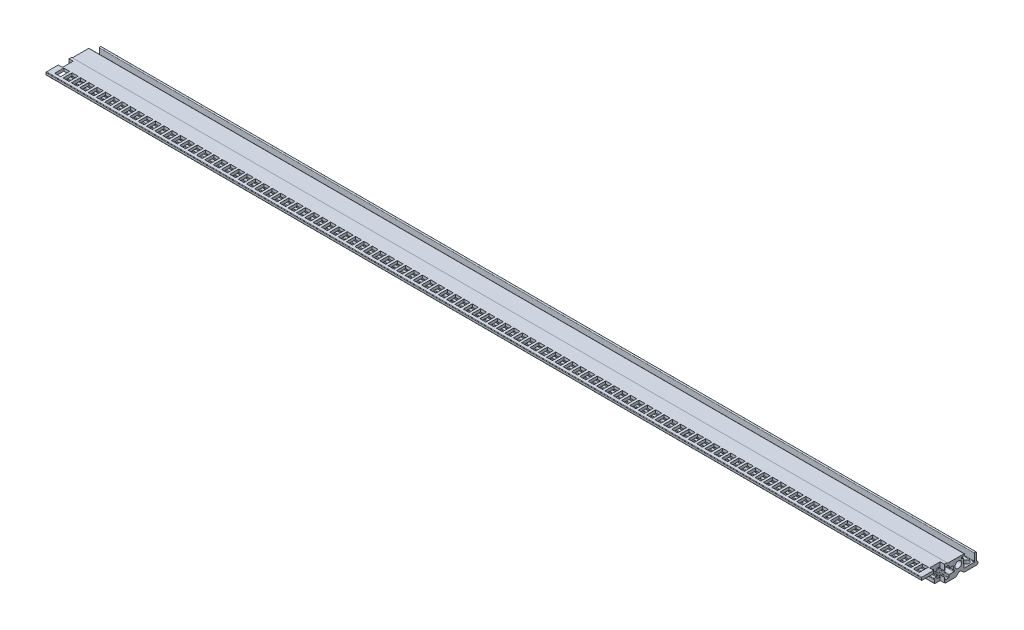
SolidWorks part; units mm, degrees
ref_plane "前视基准面" through (0, 0, 0) normal (0, 0, 1) x (1, 0, 0)
ref_plane "上视基准面" through (0, 0, 0) normal (0, 1, 0) x (1, 0, 0)
ref_plane "右视基准面" through (0, 0, 0) normal (1, 0, 0) x (0, 0, -1)
sketch "草图1" plane through (0, 0, 0) normal (1, 0, 0) x (0, 0, -1)
  line L901 (2.0061, 2.1458) -> (2.0561, 2.1458)
  line L902 (2.2561, 1.9458) -> (2.2561, -0.0542)
  line L903 (2.5561, -0.3542) -> (6.0561, -0.3542)
  line L904 (6.546, -0.7542) -> (12.6401, -0.7542)
  line L905 (12.8419, -0.6762) -> (14.6823, 0.9969)
  line L906 (15.8298, 0.9969) -> (17.6702, -0.6762)
  line L907 (17.872, -0.7542) -> (25.1561, -0.7542)
  line L908 (25.2561, 1.6874) -> (25.2561, 6.0458)
  line L909 (24.2561, 6.0458) -> (24.2561, 1.7458)
  line L910 (23.9561, 1.4458) -> (18.0561, 1.4458)
  line L911 (17.7561, 1.7458) -> (17.7561, 3.0993)
  line L912 (17.5561, 3.4458) -> (17.5561, 6.7458)
  line L913 (17.2561, 7.0458) -> (16.3561, 7.0458)
  line L914 (16.0561, 7.3458) -> (16.0561, 7.7458)
  line L915 (16.3561, 8.0458) -> (17.7561, 8.0458)
  line L916 (18.0561, 8.3458) -> (18.0561, 8.7458)
  line L917 (17.7561, 9.0458) -> (-7.9439, 9.0458)
  line L918 (-8.2439, 8.7458) -> (-8.2439, 8.1458)
  line L919 (-7.9439, 7.8458) -> (1.4561, 7.8458)
  line L920 (1.7561, 7.5458) -> (1.7561, 6.3458)
  line L921 (2.0561, 6.0458) -> (3.4561, 6.0458)
  line L922 (3.7561, 6.3458) -> (3.7561, 6.7458)
  line L923 (4.0561, 7.0458) -> (5.1561, 7.0458)
  line L924 (5.4561, 6.7458) -> (5.4561, 6.3458)
  line L925 (6.0561, 6.3458) -> (6.0561, 7.4058)
  line L926 (6.3561, 7.7058) -> (8.1561, 7.7058)
  line L927 (8.4561, 7.4058) -> (8.4561, 6.3458)
  line L928 (8.7561, 6.0458) -> (10.98, 6.0458)
  line L929 (11.646, 2.6458) -> (8.7561, 2.6458)
  line L930 (8.4561, 2.3458) -> (8.4561, 1.2858)
  line L931 (8.1561, 0.9858) -> (6.3561, 0.9858)
  line L932 (6.0561, 1.2858) -> (6.0561, 2.3458)
  line L933 (5.4561, 2.3458) -> (5.4561, 1.9458)
  line L934 (5.1561, 1.6458) -> (4.0561, 1.6458)
  line L935 (3.7561, 1.9458) -> (3.7561, 2.3458)
  line L936 (3.4561, 2.6458) -> (2.0061, 2.6458)
  circle A0 centre (14.2561, 5.0458) radius 2
  arc A133 (2.0061, 2.6458) -> (2.0061, 2.1458) centre (2.0061, 2.3958) ccw
  arc A134 (2.2561, 1.9458) -> (2.0561, 2.1458) centre (2.0561, 1.9458) ccw
  arc A135 (2.2561, -0.0542) -> (2.5561, -0.3542) centre (2.5561, -0.0542) ccw
  arc A136 (6.35, -0.5942) -> (6.0561, -0.3542) centre (6.0561, -0.6542) ccw
  arc A137 (6.35, -0.5942) -> (6.546, -0.7542) centre (6.546, -0.5542) ccw
  arc A138 (12.6401, -0.7542) -> (12.8419, -0.6762) centre (12.6401, -0.4542) ccw
  arc A139 (15.0701, 1.0103) -> (14.6823, 0.9969) centre (14.8841, 0.7749) ccw
  arc A140 (15.0701, 1.0103) -> (15.442, 1.0103) centre (15.2561, 1.2458) ccw
  arc A141 (15.8298, 0.9969) -> (15.442, 1.0103) centre (15.628, 0.7749) ccw
  arc A142 (17.6702, -0.6762) -> (17.872, -0.7542) centre (17.872, -0.4542) ccw
  arc A143 (25.1561, -0.7542) -> (25.4703, 1.3999) centre (25.1561, 0.3458) ccw
  arc A144 (25.2561, 1.6874) -> (25.4703, 1.3999) centre (25.5561, 1.6874) ccw
  arc A145 (25.2561, 6.0458) -> (24.2561, 6.0458) centre (24.7561, 6.0458) ccw
  arc A146 (23.9561, 1.4458) -> (24.2561, 1.7458) centre (23.9561, 1.7458) ccw
  arc A147 (17.7561, 1.7458) -> (18.0561, 1.4458) centre (18.0561, 1.7458) ccw
  arc A148 (17.7561, 3.0993) -> (17.6561, 3.2726) centre (17.5561, 3.0993) ccw
  arc A149 (17.5561, 3.4458) -> (17.6561, 3.2726) centre (17.7561, 3.4458) ccw
  arc A150 (17.5561, 6.7458) -> (17.2561, 7.0458) centre (17.2561, 6.7458) ccw
  arc A151 (16.0561, 7.3458) -> (16.3561, 7.0458) centre (16.3561, 7.3458) ccw
  arc A152 (16.3561, 8.0458) -> (16.0561, 7.7458) centre (16.3561, 7.7458) ccw
  arc A153 (17.7561, 8.0458) -> (18.0561, 8.3458) centre (17.7561, 8.3458) ccw
  arc A154 (18.0561, 8.7458) -> (17.7561, 9.0458) centre (17.7561, 8.7458) ccw
  arc A155 (-7.9439, 9.0458) -> (-8.2439, 8.7458) centre (-7.9439, 8.7458) ccw
  arc A156 (-8.2439, 8.1458) -> (-7.9439, 7.8458) centre (-7.9439, 8.1458) ccw
  arc A157 (1.7561, 7.5458) -> (1.4561, 7.8458) centre (1.4561, 7.5458) ccw
  arc A158 (1.7561, 6.3458) -> (2.0561, 6.0458) centre (2.0561, 6.3458) ccw
  arc A159 (3.4561, 6.0458) -> (3.7561, 6.3458) centre (3.4561, 6.3458) ccw
  arc A160 (4.0561, 7.0458) -> (3.7561, 6.7458) centre (4.0561, 6.7458) ccw
  arc A161 (5.4561, 6.7458) -> (5.1561, 7.0458) centre (5.1561, 6.7458) ccw
  arc A162 (5.4561, 6.3458) -> (6.0561, 6.3458) centre (5.7561, 6.3458) ccw
  arc A163 (6.3561, 7.7058) -> (6.0561, 7.4058) centre (6.3561, 7.4058) ccw
  arc A164 (8.4561, 7.4058) -> (8.1561, 7.7058) centre (8.1561, 7.4058) ccw
  arc A165 (8.4561, 6.3458) -> (8.7561, 6.0458) centre (8.7561, 6.3458) ccw
  arc A166 (11.2734, 5.6831) -> (10.98, 6.0458) centre (10.98, 5.7458) ccw
  arc A167 (11.2734, 5.6831) -> (11.8797, 3.1338) centre (14.2561, 5.0458) ccw
  arc A168 (11.646, 2.6458) -> (11.8797, 3.1338) centre (11.646, 2.9458) ccw
  arc A169 (8.7561, 2.6458) -> (8.4561, 2.3458) centre (8.7561, 2.3458) ccw
  arc A170 (8.1561, 0.9858) -> (8.4561, 1.2858) centre (8.1561, 1.2858) ccw
  arc A171 (6.0561, 1.2858) -> (6.3561, 0.9858) centre (6.3561, 1.2858) ccw
  arc A172 (6.0561, 2.3458) -> (5.4561, 2.3458) centre (5.7561, 2.3458) ccw
  arc A173 (5.1561, 1.6458) -> (5.4561, 1.9458) centre (5.1561, 1.9458) ccw
  arc A174 (3.7561, 1.9458) -> (4.0561, 1.6458) centre (4.0561, 1.9458) ccw
  arc A175 (3.7561, 2.3458) -> (3.4561, 2.6458) centre (3.4561, 2.3458) ccw
  dimension "D2" = 0.3
  dimension "D3" = 0.3
  dimension "D6" = 4
  dimension "D1" = 0.6
  dimension "D4" = 25.7
  dimension "D5" = 9.4
extrude "凸台-拉伸1" add sketch "草图1" along normal mid plane 533.4
sketch "草图7" plane through (266.7, 0, 0) normal (1, 0, 0) x (0, 0, -1)
  line L0 (-7.9439, 9.0458) -> (-8.2439, 9.0458)
  line L1 (-8.2439, 9.0458) -> (-8.2439, 8.7458)
  arc A0 (-7.9439, 9.0458) -> (-8.2439, 8.7458) centre (-7.9439, 8.7458) ccw construction
  arc A1 (-7.9439, 9.0458) -> (-8.2439, 8.7458) centre (-7.9439, 8.7458) ccw
extrude "凸台-拉伸4" add sketch "草图7" against normal through all
sketch "草图6" plane through (-266.7, 0, 0) normal (-1, 0, 0) x (0, 0, 1)
  line L0 (-7.8061, 9.0458) -> (8.2439, 9.0458)
  line L1 (-17.7561, 9.0458) -> (8.2439, 9.0458) construction
  line L4 (8.2439, 9.0458) -> (8.2439, 9.5458)
  line L5 (8.2439, 9.5458) -> (-7.3061, 9.5458)
  line L6 (-7.3061, 9.5458) -> (-7.8061, 9.0458)
extrude "凸台-拉伸3" add sketch "草图6" against normal through all
sketch "草图3" plane through (0, 9.5458, 0) normal (0, 1, 0) x (1, 0, 0)
  line L0 (266.7, 17.7561) -> (266.7, 7.8061) construction
  line L1 (266.7, 5.7561) -> (264.16, 5.7561)
  line L2 (266.7, 5.7561) -> (266.7, -0.7439)
  line L3 (266.7, -0.7439) -> (264.16, -0.7439)
  line L4 (264.16, 5.7561) -> (264.16, -0.7439)
  line L5 (266.7, -8.2439) -> (-266.7, -8.2439) construction
  line L7 (0, -8.2439) -> (0, 17.7561) construction
  line L9 (266.7, 17.7561) -> (-266.7, 17.7561) construction
  line L10 (-264.16, 5.7561) -> (-264.16, -0.7439)
  line L11 (-266.7, -0.7439) -> (-264.16, -0.7439)
  line L12 (-266.7, 5.7561) -> (-266.7, -0.7439)
  line L13 (-266.7, 5.7561) -> (-264.16, 5.7561)
  dimension "D1" = 2.54
  dimension "D2" = 7.5
  dimension "D3" = 6.5
extrude "切除-拉伸1" cut sketch "草图3" against normal up to surface (10.3 mm away)
sketch "草图4" plane through (0, -0.7542, 0) normal (0, -1, 0) x (-1, 0, 0)
  line L0 (-264.16, 1.7561) -> (264.16, 1.7561) construction
  line L1 (-266.7, 17.872) -> (-266.7, 25.1561) construction
  circle A0 centre (-264.16, 21.7061) radius 1.65
  circle A1 centre (-259.08, 21.7061) radius 1.65
  circle A2 centre (-254, 21.7061) radius 1.65
  circle A3 centre (-248.92, 21.7061) radius 1.65
  circle A4 centre (-243.84, 21.7061) radius 1.65
  circle A5 centre (-238.76, 21.7061) radius 1.65
  circle A6 centre (-233.68, 21.7061) radius 1.65
  circle A7 centre (-228.6, 21.7061) radius 1.65
  circle A8 centre (-223.52, 21.7061) radius 1.65
  circle A9 centre (-218.44, 21.7061) radius 1.65
  circle A10 centre (-213.36, 21.7061) radius 1.65
  circle A11 centre (-208.28, 21.7061) radius 1.65
  circle A12 centre (-203.2, 21.7061) radius 1.65
  circle A13 centre (-198.12, 21.7061) radius 1.65
  circle A14 centre (-193.04, 21.7061) radius 1.65
  circle A15 centre (-187.96, 21.7061) radius 1.65
  circle A16 centre (-182.88, 21.7061) radius 1.65
  circle A17 centre (-177.8, 21.7061) radius 1.65
  circle A18 centre (-172.72, 21.7061) radius 1.65
  circle A19 centre (-167.64, 21.7061) radius 1.65
  circle A20 centre (-162.56, 21.7061) radius 1.65
  circle A21 centre (-157.48, 21.7061) radius 1.65
  circle A22 centre (-152.4, 21.7061) radius 1.65
  circle A23 centre (-147.32, 21.7061) radius 1.65
  circle A24 centre (-142.24, 21.7061) radius 1.65
  circle A25 centre (-137.16, 21.7061) radius 1.65
  circle A26 centre (-132.08, 21.7061) radius 1.65
  circle A27 centre (-127, 21.7061) radius 1.65
  circle A28 centre (-121.92, 21.7061) radius 1.65
  circle A29 centre (-116.84, 21.7061) radius 1.65
  circle A30 centre (-111.76, 21.7061) radius 1.65
  circle A31 centre (-106.68, 21.7061) radius 1.65
  circle A32 centre (-101.6, 21.7061) radius 1.65
  circle A33 centre (-96.52, 21.7061) radius 1.65
  circle A34 centre (-91.44, 21.7061) radius 1.65
  circle A35 centre (-86.36, 21.7061) radius 1.65
  circle A36 centre (-81.28, 21.7061) radius 1.65
  circle A37 centre (-76.2, 21.7061) radius 1.65
  circle A38 centre (-71.12, 21.7061) radius 1.65
  circle A39 centre (-66.04, 21.7061) radius 1.65
  circle A40 centre (-60.96, 21.7061) radius 1.65
  circle A41 centre (-55.88, 21.7061) radius 1.65
  circle A42 centre (-50.8, 21.7061) radius 1.65
  circle A43 centre (-45.72, 21.7061) radius 1.65
  circle A44 centre (-40.64, 21.7061) radius 1.65
  circle A45 centre (-35.56, 21.7061) radius 1.65
  circle A46 centre (-30.48, 21.7061) radius 1.65
  circle A47 centre (-25.4, 21.7061) radius 1.65
  circle A48 centre (-20.32, 21.7061) radius 1.65
  circle A49 centre (-15.24, 21.7061) radius 1.65
  circle A50 centre (-10.16, 21.7061) radius 1.65
  circle A51 centre (-5.08, 21.7061) radius 1.65
  circle A52 centre (0, 21.7061) radius 1.65
  circle A53 centre (5.08, 21.7061) radius 1.65
  circle A54 centre (10.16, 21.7061) radius 1.65
  circle A55 centre (15.24, 21.7061) radius 1.65
  circle A56 centre (20.32, 21.7061) radius 1.65
  circle A57 centre (25.4, 21.7061) radius 1.65
  circle A58 centre (30.48, 21.7061) radius 1.65
  circle A59 centre (35.56, 21.7061) radius 1.65
  circle A60 centre (40.64, 21.7061) radius 1.65
  circle A61 centre (45.72, 21.7061) radius 1.65
  circle A62 centre (50.8, 21.7061) radius 1.65
  circle A63 centre (55.88, 21.7061) radius 1.65
  circle A64 centre (60.96, 21.7061) radius 1.65
  circle A65 centre (66.04, 21.7061) radius 1.65
  circle A66 centre (71.12, 21.7061) radius 1.65
  circle A67 centre (76.2, 21.7061) radius 1.65
  circle A68 centre (81.28, 21.7061) radius 1.65
  circle A69 centre (86.36, 21.7061) radius 1.65
  circle A70 centre (91.44, 21.7061) radius 1.65
  circle A71 centre (96.52, 21.7061) radius 1.65
  circle A72 centre (101.6, 21.7061) radius 1.65
  circle A73 centre (106.68, 21.7061) radius 1.65
  circle A74 centre (111.76, 21.7061) radius 1.65
  circle A75 centre (116.84, 21.7061) radius 1.65
  circle A76 centre (121.92, 21.7061) radius 1.65
  circle A77 centre (127, 21.7061) radius 1.65
  circle A78 centre (132.08, 21.7061) radius 1.65
  circle A79 centre (137.16, 21.7061) radius 1.65
  circle A80 centre (142.24, 21.7061) radius 1.65
  circle A81 centre (147.32, 21.7061) radius 1.65
  circle A82 centre (152.4, 21.7061) radius 1.65
  circle A83 centre (157.48, 21.7061) radius 1.65
  circle A84 centre (162.56, 21.7061) radius 1.65
  circle A85 centre (167.64, 21.7061) radius 1.65
  circle A86 centre (172.72, 21.7061) radius 1.65
  circle A87 centre (177.8, 21.7061) radius 1.65
  circle A88 centre (182.88, 21.7061) radius 1.65
  circle A89 centre (187.96, 21.7061) radius 1.65
  circle A90 centre (193.04, 21.7061) radius 1.65
  circle A91 centre (198.12, 21.7061) radius 1.65
  circle A92 centre (203.2, 21.7061) radius 1.65
  circle A93 centre (208.28, 21.7061) radius 1.65
  circle A94 centre (213.36, 21.7061) radius 1.65
  circle A95 centre (218.44, 21.7061) radius 1.65
  circle A96 centre (223.52, 21.7061) radius 1.65
  circle A97 centre (228.6, 21.7061) radius 1.65
  circle A98 centre (233.68, 21.7061) radius 1.65
  circle A99 centre (238.76, 21.7061) radius 1.65
  circle A100 centre (243.84, 21.7061) radius 1.65
  circle A101 centre (248.92, 21.7061) radius 1.65
  circle A102 centre (254, 21.7061) radius 1.65
  circle A103 centre (259.08, 21.7061) radius 1.65
  circle A104 centre (264.16, 21.7061) radius 1.65
extrude "切除-拉伸2" cut sketch "草图4" against normal up to surface (9.8 mm away)
sketch "草图5" plane through (0, 9.5458, 0) normal (0, 1, 0) x (1, 0, 0)
  line L0 (-266.7, 17.7561) -> (-266.7, 7.8061) construction
  line L1 (-259.82, -6.1939) -> (-263.42, -6.1939)
  line L2 (-259.82, -6.1939) -> (-259.82, -0.6939)
  line L3 (-259.82, -0.6939) -> (-263.42, -0.6939)
  line L4 (-263.42, -6.1939) -> (-263.42, -0.6939)
  line L5 (-259.82, -6.1939) -> (-263.42, -0.6939) construction
  line L6 (-259.82, -0.6939) -> (-263.42, -6.1939) construction
  line L7 (166.9, -6.1939) -> (163.3, -6.1939)
  line L8 (-254.74, -6.1939) -> (-258.34, -6.1939)
  line L9 (-254.74, -6.1939) -> (-254.74, -0.6939)
  line L10 (-254.74, -0.6939) -> (-258.34, -0.6939)
  line L11 (-258.34, -6.1939) -> (-258.34, -0.6939)
  line L12 (-254.74, -6.1939) -> (-258.34, -0.6939) construction
  line L13 (-254.74, -0.6939) -> (-258.34, -6.1939) construction
  line L14 (-249.66, -6.1939) -> (-253.26, -6.1939)
  line L15 (-249.66, -6.1939) -> (-249.66, -0.6939)
  line L16 (-249.66, -0.6939) -> (-253.26, -0.6939)
  line L17 (-253.26, -6.1939) -> (-253.26, -0.6939)
  line L18 (-249.66, -6.1939) -> (-253.26, -0.6939) construction
  line L19 (-249.66, -0.6939) -> (-253.26, -6.1939) construction
  line L20 (-244.58, -6.1939) -> (-248.18, -6.1939)
  line L21 (-244.58, -6.1939) -> (-244.58, -0.6939)
  line L22 (-244.58, -0.6939) -> (-248.18, -0.6939)
  line L23 (-248.18, -6.1939) -> (-248.18, -0.6939)
  line L24 (-244.58, -6.1939) -> (-248.18, -0.6939) construction
  line L25 (-244.58, -0.6939) -> (-248.18, -6.1939) construction
  line L26 (-239.5, -6.1939) -> (-243.1, -6.1939)
  line L27 (-239.5, -6.1939) -> (-239.5, -0.6939)
  line L28 (-239.5, -0.6939) -> (-243.1, -0.6939)
  line L29 (-243.1, -6.1939) -> (-243.1, -0.6939)
  line L30 (-239.5, -6.1939) -> (-243.1, -0.6939) construction
  line L31 (-239.5, -0.6939) -> (-243.1, -6.1939) construction
  line L32 (-234.42, -6.1939) -> (-238.02, -6.1939)
  line L33 (-234.42, -6.1939) -> (-234.42, -0.6939)
  line L34 (-234.42, -0.6939) -> (-238.02, -0.6939)
  line L35 (-238.02, -6.1939) -> (-238.02, -0.6939)
  line L36 (-234.42, -6.1939) -> (-238.02, -0.6939) construction
  line L37 (-234.42, -0.6939) -> (-238.02, -6.1939) construction
  line L38 (-229.34, -6.1939) -> (-232.94, -6.1939)
  line L39 (-229.34, -6.1939) -> (-229.34, -0.6939)
  line L40 (-229.34, -0.6939) -> (-232.94, -0.6939)
  line L41 (-232.94, -6.1939) -> (-232.94, -0.6939)
  line L42 (-229.34, -6.1939) -> (-232.94, -0.6939) construction
  line L43 (-229.34, -0.6939) -> (-232.94, -6.1939) construction
  line L44 (-224.26, -6.1939) -> (-227.86, -6.1939)
  line L45 (-224.26, -6.1939) -> (-224.26, -0.6939)
  line L46 (-224.26, -0.6939) -> (-227.86, -0.6939)
  line L47 (-227.86, -6.1939) -> (-227.86, -0.6939)
  line L48 (-224.26, -6.1939) -> (-227.86, -0.6939) construction
  line L49 (-224.26, -0.6939) -> (-227.86, -6.1939) construction
  line L50 (-219.18, -6.1939) -> (-222.78, -6.1939)
  line L51 (-219.18, -6.1939) -> (-219.18, -0.6939)
  line L52 (-219.18, -0.6939) -> (-222.78, -0.6939)
  line L53 (-222.78, -6.1939) -> (-222.78, -0.6939)
  line L54 (-219.18, -6.1939) -> (-222.78, -0.6939) construction
  line L55 (-219.18, -0.6939) -> (-222.78, -6.1939) construction
  line L56 (-214.1, -6.1939) -> (-217.7, -6.1939)
  line L57 (-214.1, -6.1939) -> (-214.1, -0.6939)
  line L58 (-214.1, -0.6939) -> (-217.7, -0.6939)
  line L59 (-217.7, -6.1939) -> (-217.7, -0.6939)
  line L60 (-214.1, -6.1939) -> (-217.7, -0.6939) construction
  line L61 (-214.1, -0.6939) -> (-217.7, -6.1939) construction
  line L62 (-209.02, -6.1939) -> (-212.62, -6.1939)
  line L63 (-209.02, -6.1939) -> (-209.02, -0.6939)
  line L64 (-209.02, -0.6939) -> (-212.62, -0.6939)
  line L65 (-212.62, -6.1939) -> (-212.62, -0.6939)
  line L66 (-209.02, -6.1939) -> (-212.62, -0.6939) construction
  line L67 (-209.02, -0.6939) -> (-212.62, -6.1939) construction
  line L68 (-203.94, -6.1939) -> (-207.54, -6.1939)
  line L69 (-203.94, -6.1939) -> (-203.94, -0.6939)
  line L70 (-203.94, -0.6939) -> (-207.54, -0.6939)
  line L71 (-207.54, -6.1939) -> (-207.54, -0.6939)
  line L72 (-203.94, -6.1939) -> (-207.54, -0.6939) construction
  line L73 (-203.94, -0.6939) -> (-207.54, -6.1939) construction
  line L74 (-198.86, -6.1939) -> (-202.46, -6.1939)
  line L75 (-198.86, -6.1939) -> (-198.86, -0.6939)
  line L76 (-198.86, -0.6939) -> (-202.46, -0.6939)
  line L77 (-202.46, -6.1939) -> (-202.46, -0.6939)
  line L78 (-198.86, -6.1939) -> (-202.46, -0.6939) construction
  line L79 (-198.86, -0.6939) -> (-202.46, -6.1939) construction
  line L80 (-193.78, -6.1939) -> (-197.38, -6.1939)
  line L81 (-193.78, -6.1939) -> (-193.78, -0.6939)
  line L82 (-193.78, -0.6939) -> (-197.38, -0.6939)
  line L83 (-197.38, -6.1939) -> (-197.38, -0.6939)
  line L84 (-193.78, -6.1939) -> (-197.38, -0.6939) construction
  line L85 (-193.78, -0.6939) -> (-197.38, -6.1939) construction
  line L86 (-188.7, -6.1939) -> (-192.3, -6.1939)
  line L87 (-188.7, -6.1939) -> (-188.7, -0.6939)
  line L88 (-188.7, -0.6939) -> (-192.3, -0.6939)
  line L89 (-192.3, -6.1939) -> (-192.3, -0.6939)
  line L90 (-188.7, -6.1939) -> (-192.3, -0.6939) construction
  line L91 (-188.7, -0.6939) -> (-192.3, -6.1939) construction
  line L92 (-183.62, -6.1939) -> (-187.22, -6.1939)
  line L93 (-183.62, -6.1939) -> (-183.62, -0.6939)
  line L94 (-183.62, -0.6939) -> (-187.22, -0.6939)
  line L95 (-187.22, -6.1939) -> (-187.22, -0.6939)
  line L96 (-183.62, -6.1939) -> (-187.22, -0.6939) construction
  line L97 (-183.62, -0.6939) -> (-187.22, -6.1939) construction
  line L98 (-178.54, -6.1939) -> (-182.14, -6.1939)
  line L99 (-178.54, -6.1939) -> (-178.54, -0.6939)
  line L100 (-178.54, -0.6939) -> (-182.14, -0.6939)
  line L101 (-182.14, -6.1939) -> (-182.14, -0.6939)
  line L102 (-178.54, -6.1939) -> (-182.14, -0.6939) construction
  line L103 (-178.54, -0.6939) -> (-182.14, -6.1939) construction
  line L104 (-173.46, -6.1939) -> (-177.06, -6.1939)
  line L105 (-173.46, -6.1939) -> (-173.46, -0.6939)
  line L106 (-173.46, -0.6939) -> (-177.06, -0.6939)
  line L107 (-177.06, -6.1939) -> (-177.06, -0.6939)
  line L108 (-173.46, -6.1939) -> (-177.06, -0.6939) construction
  line L109 (-173.46, -0.6939) -> (-177.06, -6.1939) construction
  line L110 (-168.38, -6.1939) -> (-171.98, -6.1939)
  line L111 (-168.38, -6.1939) -> (-168.38, -0.6939)
  line L112 (-168.38, -0.6939) -> (-171.98, -0.6939)
  line L113 (-171.98, -6.1939) -> (-171.98, -0.6939)
  line L114 (-168.38, -6.1939) -> (-171.98, -0.6939) construction
  line L115 (-168.38, -0.6939) -> (-171.98, -6.1939) construction
  line L116 (-163.3, -6.1939) -> (-166.9, -6.1939)
  line L117 (-163.3, -6.1939) -> (-163.3, -0.6939)
  line L118 (-163.3, -0.6939) -> (-166.9, -0.6939)
  line L119 (-166.9, -6.1939) -> (-166.9, -0.6939)
  line L120 (-163.3, -6.1939) -> (-166.9, -0.6939) construction
  line L121 (-163.3, -0.6939) -> (-166.9, -6.1939) construction
  line L122 (-158.22, -6.1939) -> (-161.82, -6.1939)
  line L123 (-158.22, -6.1939) -> (-158.22, -0.6939)
  line L124 (-158.22, -0.6939) -> (-161.82, -0.6939)
  line L125 (-161.82, -6.1939) -> (-161.82, -0.6939)
  line L126 (-158.22, -6.1939) -> (-161.82, -0.6939) construction
  line L127 (-158.22, -0.6939) -> (-161.82, -6.1939) construction
  line L128 (-153.14, -6.1939) -> (-156.74, -6.1939)
  line L129 (-153.14, -6.1939) -> (-153.14, -0.6939)
  line L130 (-153.14, -0.6939) -> (-156.74, -0.6939)
  line L131 (-156.74, -6.1939) -> (-156.74, -0.6939)
  line L132 (-153.14, -6.1939) -> (-156.74, -0.6939) construction
  line L133 (-153.14, -0.6939) -> (-156.74, -6.1939) construction
  line L134 (-148.06, -6.1939) -> (-151.66, -6.1939)
  line L135 (-148.06, -6.1939) -> (-148.06, -0.6939)
  line L136 (-148.06, -0.6939) -> (-151.66, -0.6939)
  line L137 (-151.66, -6.1939) -> (-151.66, -0.6939)
  line L138 (-148.06, -6.1939) -> (-151.66, -0.6939) construction
  line L139 (-148.06, -0.6939) -> (-151.66, -6.1939) construction
  line L140 (-142.98, -6.1939) -> (-146.58, -6.1939)
  line L141 (-142.98, -6.1939) -> (-142.98, -0.6939)
  line L142 (-142.98, -0.6939) -> (-146.58, -0.6939)
  line L143 (-146.58, -6.1939) -> (-146.58, -0.6939)
  line L144 (-142.98, -6.1939) -> (-146.58, -0.6939) construction
  line L145 (-142.98, -0.6939) -> (-146.58, -6.1939) construction
  line L146 (-137.9, -6.1939) -> (-141.5, -6.1939)
  line L147 (-137.9, -6.1939) -> (-137.9, -0.6939)
  line L148 (-137.9, -0.6939) -> (-141.5, -0.6939)
  line L149 (-141.5, -6.1939) -> (-141.5, -0.6939)
  line L150 (-137.9, -6.1939) -> (-141.5, -0.6939) construction
  line L151 (-137.9, -0.6939) -> (-141.5, -6.1939) construction
  line L152 (-132.82, -6.1939) -> (-136.42, -6.1939)
  line L153 (-132.82, -6.1939) -> (-132.82, -0.6939)
  line L154 (-132.82, -0.6939) -> (-136.42, -0.6939)
  line L155 (-136.42, -6.1939) -> (-136.42, -0.6939)
  line L156 (-132.82, -6.1939) -> (-136.42, -0.6939) construction
  line L157 (-132.82, -0.6939) -> (-136.42, -6.1939) construction
  line L158 (-127.74, -6.1939) -> (-131.34, -6.1939)
  line L159 (-127.74, -6.1939) -> (-127.74, -0.6939)
  line L160 (-127.74, -0.6939) -> (-131.34, -0.6939)
  line L161 (-131.34, -6.1939) -> (-131.34, -0.6939)
  line L162 (-127.74, -6.1939) -> (-131.34, -0.6939) construction
  line L163 (-127.74, -0.6939) -> (-131.34, -6.1939) construction
  line L164 (-122.66, -6.1939) -> (-126.26, -6.1939)
  line L165 (-122.66, -6.1939) -> (-122.66, -0.6939)
  line L166 (-122.66, -0.6939) -> (-126.26, -0.6939)
  line L167 (-126.26, -6.1939) -> (-126.26, -0.6939)
  line L168 (-122.66, -6.1939) -> (-126.26, -0.6939) construction
  line L169 (-122.66, -0.6939) -> (-126.26, -6.1939) construction
  line L170 (-117.58, -6.1939) -> (-121.18, -6.1939)
  line L171 (-117.58, -6.1939) -> (-117.58, -0.6939)
  line L172 (-117.58, -0.6939) -> (-121.18, -0.6939)
  line L173 (-121.18, -6.1939) -> (-121.18, -0.6939)
  line L174 (-117.58, -6.1939) -> (-121.18, -0.6939) construction
  line L175 (-117.58, -0.6939) -> (-121.18, -6.1939) construction
  line L176 (-112.5, -6.1939) -> (-116.1, -6.1939)
  line L177 (-112.5, -6.1939) -> (-112.5, -0.6939)
  line L178 (-112.5, -0.6939) -> (-116.1, -0.6939)
  line L179 (-116.1, -6.1939) -> (-116.1, -0.6939)
  line L180 (-112.5, -6.1939) -> (-116.1, -0.6939) construction
  line L181 (-112.5, -0.6939) -> (-116.1, -6.1939) construction
  line L182 (-107.42, -6.1939) -> (-111.02, -6.1939)
  line L183 (-107.42, -6.1939) -> (-107.42, -0.6939)
  line L184 (-107.42, -0.6939) -> (-111.02, -0.6939)
  line L185 (-111.02, -6.1939) -> (-111.02, -0.6939)
  line L186 (-107.42, -6.1939) -> (-111.02, -0.6939) construction
  line L187 (-107.42, -0.6939) -> (-111.02, -6.1939) construction
  line L188 (-102.34, -6.1939) -> (-105.94, -6.1939)
  line L189 (-102.34, -6.1939) -> (-102.34, -0.6939)
  line L190 (-102.34, -0.6939) -> (-105.94, -0.6939)
  line L191 (-105.94, -6.1939) -> (-105.94, -0.6939)
  line L192 (-102.34, -6.1939) -> (-105.94, -0.6939) construction
  line L193 (-102.34, -0.6939) -> (-105.94, -6.1939) construction
  line L194 (-97.26, -6.1939) -> (-100.86, -6.1939)
  line L195 (-97.26, -6.1939) -> (-97.26, -0.6939)
  line L196 (-97.26, -0.6939) -> (-100.86, -0.6939)
  line L197 (-100.86, -6.1939) -> (-100.86, -0.6939)
  line L198 (-97.26, -6.1939) -> (-100.86, -0.6939) construction
  line L199 (-97.26, -0.6939) -> (-100.86, -6.1939) construction
  line L200 (-92.18, -6.1939) -> (-95.78, -6.1939)
  line L201 (-92.18, -6.1939) -> (-92.18, -0.6939)
  line L202 (-92.18, -0.6939) -> (-95.78, -0.6939)
  line L203 (-95.78, -6.1939) -> (-95.78, -0.6939)
  line L204 (-92.18, -6.1939) -> (-95.78, -0.6939) construction
  line L205 (-92.18, -0.6939) -> (-95.78, -6.1939) construction
  line L206 (-87.1, -6.1939) -> (-90.7, -6.1939)
  line L207 (-87.1, -6.1939) -> (-87.1, -0.6939)
  line L208 (-87.1, -0.6939) -> (-90.7, -0.6939)
  line L209 (-90.7, -6.1939) -> (-90.7, -0.6939)
  line L210 (-87.1, -6.1939) -> (-90.7, -0.6939) construction
  line L211 (-87.1, -0.6939) -> (-90.7, -6.1939) construction
  line L212 (-82.02, -6.1939) -> (-85.62, -6.1939)
  line L213 (-82.02, -6.1939) -> (-82.02, -0.6939)
  line L214 (-82.02, -0.6939) -> (-85.62, -0.6939)
  line L215 (-85.62, -6.1939) -> (-85.62, -0.6939)
  line L216 (-82.02, -6.1939) -> (-85.62, -0.6939) construction
  line L217 (-82.02, -0.6939) -> (-85.62, -6.1939) construction
  line L218 (-76.94, -6.1939) -> (-80.54, -6.1939)
  line L219 (-76.94, -6.1939) -> (-76.94, -0.6939)
  line L220 (-76.94, -0.6939) -> (-80.54, -0.6939)
  line L221 (-80.54, -6.1939) -> (-80.54, -0.6939)
  line L222 (-76.94, -6.1939) -> (-80.54, -0.6939) construction
  line L223 (-76.94, -0.6939) -> (-80.54, -6.1939) construction
  line L224 (-71.86, -6.1939) -> (-75.46, -6.1939)
  line L225 (-71.86, -6.1939) -> (-71.86, -0.6939)
  line L226 (-71.86, -0.6939) -> (-75.46, -0.6939)
  line L227 (-75.46, -6.1939) -> (-75.46, -0.6939)
  line L228 (-71.86, -6.1939) -> (-75.46, -0.6939) construction
  line L229 (-71.86, -0.6939) -> (-75.46, -6.1939) construction
  line L230 (-66.78, -6.1939) -> (-70.38, -6.1939)
  line L231 (-66.78, -6.1939) -> (-66.78, -0.6939)
  line L232 (-66.78, -0.6939) -> (-70.38, -0.6939)
  line L233 (-70.38, -6.1939) -> (-70.38, -0.6939)
  line L234 (-66.78, -6.1939) -> (-70.38, -0.6939) construction
  line L235 (-66.78, -0.6939) -> (-70.38, -6.1939) construction
  line L236 (-61.7, -6.1939) -> (-65.3, -6.1939)
  line L237 (-61.7, -6.1939) -> (-61.7, -0.6939)
  line L238 (-61.7, -0.6939) -> (-65.3, -0.6939)
  line L239 (-65.3, -6.1939) -> (-65.3, -0.6939)
  line L240 (-61.7, -6.1939) -> (-65.3, -0.6939) construction
  line L241 (-61.7, -0.6939) -> (-65.3, -6.1939) construction
  line L242 (-56.62, -6.1939) -> (-60.22, -6.1939)
  line L243 (-56.62, -6.1939) -> (-56.62, -0.6939)
  line L244 (-56.62, -0.6939) -> (-60.22, -0.6939)
  line L245 (-60.22, -6.1939) -> (-60.22, -0.6939)
  line L246 (-56.62, -6.1939) -> (-60.22, -0.6939) construction
  line L247 (-56.62, -0.6939) -> (-60.22, -6.1939) construction
  line L248 (-51.54, -6.1939) -> (-55.14, -6.1939)
  line L249 (-51.54, -6.1939) -> (-51.54, -0.6939)
  line L250 (-51.54, -0.6939) -> (-55.14, -0.6939)
  line L251 (-55.14, -6.1939) -> (-55.14, -0.6939)
  line L252 (-51.54, -6.1939) -> (-55.14, -0.6939) construction
  line L253 (-51.54, -0.6939) -> (-55.14, -6.1939) construction
  line L254 (-46.46, -6.1939) -> (-50.06, -6.1939)
  line L255 (-46.46, -6.1939) -> (-46.46, -0.6939)
  line L256 (-46.46, -0.6939) -> (-50.06, -0.6939)
  line L257 (-50.06, -6.1939) -> (-50.06, -0.6939)
  line L258 (-46.46, -6.1939) -> (-50.06, -0.6939) construction
  line L259 (-46.46, -0.6939) -> (-50.06, -6.1939) construction
  line L260 (-41.38, -6.1939) -> (-44.98, -6.1939)
  line L261 (-41.38, -6.1939) -> (-41.38, -0.6939)
  line L262 (-41.38, -0.6939) -> (-44.98, -0.6939)
  line L263 (-44.98, -6.1939) -> (-44.98, -0.6939)
  line L264 (-41.38, -6.1939) -> (-44.98, -0.6939) construction
  line L265 (-41.38, -0.6939) -> (-44.98, -6.1939) construction
  line L266 (-36.3, -6.1939) -> (-39.9, -6.1939)
  line L267 (-36.3, -6.1939) -> (-36.3, -0.6939)
  line L268 (-36.3, -0.6939) -> (-39.9, -0.6939)
  line L269 (-39.9, -6.1939) -> (-39.9, -0.6939)
  line L270 (-36.3, -6.1939) -> (-39.9, -0.6939) construction
  line L271 (-36.3, -0.6939) -> (-39.9, -6.1939) construction
  line L272 (-31.22, -6.1939) -> (-34.82, -6.1939)
  line L273 (-31.22, -6.1939) -> (-31.22, -0.6939)
  line L274 (-31.22, -0.6939) -> (-34.82, -0.6939)
  line L275 (-34.82, -6.1939) -> (-34.82, -0.6939)
  line L276 (-31.22, -6.1939) -> (-34.82, -0.6939) construction
  line L277 (-31.22, -0.6939) -> (-34.82, -6.1939) construction
  line L278 (-26.14, -6.1939) -> (-29.74, -6.1939)
  line L279 (-26.14, -6.1939) -> (-26.14, -0.6939)
  line L280 (-26.14, -0.6939) -> (-29.74, -0.6939)
  line L281 (-29.74, -6.1939) -> (-29.74, -0.6939)
  line L282 (-26.14, -6.1939) -> (-29.74, -0.6939) construction
  line L283 (-26.14, -0.6939) -> (-29.74, -6.1939) construction
  line L284 (-21.06, -6.1939) -> (-24.66, -6.1939)
  line L285 (-21.06, -6.1939) -> (-21.06, -0.6939)
  line L286 (-21.06, -0.6939) -> (-24.66, -0.6939)
  line L287 (-24.66, -6.1939) -> (-24.66, -0.6939)
  line L288 (-21.06, -6.1939) -> (-24.66, -0.6939) construction
  line L289 (-21.06, -0.6939) -> (-24.66, -6.1939) construction
  line L290 (-15.98, -6.1939) -> (-19.58, -6.1939)
  line L291 (-15.98, -6.1939) -> (-15.98, -0.6939)
  line L292 (-15.98, -0.6939) -> (-19.58, -0.6939)
  line L293 (-19.58, -6.1939) -> (-19.58, -0.6939)
  line L294 (-15.98, -6.1939) -> (-19.58, -0.6939) construction
  line L295 (-15.98, -0.6939) -> (-19.58, -6.1939) construction
  line L296 (-10.9, -6.1939) -> (-14.5, -6.1939)
  line L297 (-10.9, -6.1939) -> (-10.9, -0.6939)
  line L298 (-10.9, -0.6939) -> (-14.5, -0.6939)
  line L299 (-14.5, -6.1939) -> (-14.5, -0.6939)
  line L300 (-10.9, -6.1939) -> (-14.5, -0.6939) construction
  line L301 (-10.9, -0.6939) -> (-14.5, -6.1939) construction
  line L302 (-5.82, -6.1939) -> (-9.42, -6.1939)
  line L303 (-5.82, -6.1939) -> (-5.82, -0.6939)
  line L304 (-5.82, -0.6939) -> (-9.42, -0.6939)
  line L305 (-9.42, -6.1939) -> (-9.42, -0.6939)
  line L306 (-5.82, -6.1939) -> (-9.42, -0.6939) construction
  line L307 (-5.82, -0.6939) -> (-9.42, -6.1939) construction
  line L308 (-0.74, -6.1939) -> (-4.34, -6.1939)
  line L309 (-0.74, -6.1939) -> (-0.74, -0.6939)
  line L310 (-0.74, -0.6939) -> (-4.34, -0.6939)
  line L311 (-4.34, -6.1939) -> (-4.34, -0.6939)
  line L312 (-0.74, -6.1939) -> (-4.34, -0.6939) construction
  line L313 (-0.74, -0.6939) -> (-4.34, -6.1939) construction
  line L314 (4.34, -6.1939) -> (0.74, -6.1939)
  line L315 (4.34, -6.1939) -> (4.34, -0.6939)
  line L316 (4.34, -0.6939) -> (0.74, -0.6939)
  line L317 (0.74, -6.1939) -> (0.74, -0.6939)
  line L318 (4.34, -6.1939) -> (0.74, -0.6939) construction
  line L319 (4.34, -0.6939) -> (0.74, -6.1939) construction
  line L320 (9.42, -6.1939) -> (5.82, -6.1939)
  line L321 (9.42, -6.1939) -> (9.42, -0.6939)
  line L322 (9.42, -0.6939) -> (5.82, -0.6939)
  line L323 (5.82, -6.1939) -> (5.82, -0.6939)
  line L324 (9.42, -6.1939) -> (5.82, -0.6939) construction
  line L325 (9.42, -0.6939) -> (5.82, -6.1939) construction
  line L326 (14.5, -6.1939) -> (10.9, -6.1939)
  line L327 (14.5, -6.1939) -> (14.5, -0.6939)
  line L328 (14.5, -0.6939) -> (10.9, -0.6939)
  line L329 (10.9, -6.1939) -> (10.9, -0.6939)
  line L330 (14.5, -6.1939) -> (10.9, -0.6939) construction
  line L331 (14.5, -0.6939) -> (10.9, -6.1939) construction
  line L332 (19.58, -6.1939) -> (15.98, -6.1939)
  line L333 (19.58, -6.1939) -> (19.58, -0.6939)
  line L334 (19.58, -0.6939) -> (15.98, -0.6939)
  line L335 (15.98, -6.1939) -> (15.98, -0.6939)
  line L336 (19.58, -6.1939) -> (15.98, -0.6939) construction
  line L337 (19.58, -0.6939) -> (15.98, -6.1939) construction
  line L338 (24.66, -6.1939) -> (21.06, -6.1939)
  line L339 (24.66, -6.1939) -> (24.66, -0.6939)
  line L340 (24.66, -0.6939) -> (21.06, -0.6939)
  line L341 (21.06, -6.1939) -> (21.06, -0.6939)
  line L342 (24.66, -6.1939) -> (21.06, -0.6939) construction
  line L343 (24.66, -0.6939) -> (21.06, -6.1939) construction
  line L344 (29.74, -6.1939) -> (26.14, -6.1939)
  line L345 (29.74, -6.1939) -> (29.74, -0.6939)
  line L346 (29.74, -0.6939) -> (26.14, -0.6939)
  line L347 (26.14, -6.1939) -> (26.14, -0.6939)
  line L348 (29.74, -6.1939) -> (26.14, -0.6939) construction
  line L349 (29.74, -0.6939) -> (26.14, -6.1939) construction
  line L350 (34.82, -6.1939) -> (31.22, -6.1939)
  line L351 (34.82, -6.1939) -> (34.82, -0.6939)
  line L352 (34.82, -0.6939) -> (31.22, -0.6939)
  line L353 (31.22, -6.1939) -> (31.22, -0.6939)
  line L354 (34.82, -6.1939) -> (31.22, -0.6939) construction
  line L355 (34.82, -0.6939) -> (31.22, -6.1939) construction
  line L356 (39.9, -6.1939) -> (36.3, -6.1939)
  line L357 (39.9, -6.1939) -> (39.9, -0.6939)
  line L358 (39.9, -0.6939) -> (36.3, -0.6939)
  line L359 (36.3, -6.1939) -> (36.3, -0.6939)
  line L360 (39.9, -6.1939) -> (36.3, -0.6939) construction
  line L361 (39.9, -0.6939) -> (36.3, -6.1939) construction
  line L362 (44.98, -6.1939) -> (41.38, -6.1939)
  line L363 (44.98, -6.1939) -> (44.98, -0.6939)
  line L364 (44.98, -0.6939) -> (41.38, -0.6939)
  line L365 (41.38, -6.1939) -> (41.38, -0.6939)
  line L366 (44.98, -6.1939) -> (41.38, -0.6939) construction
  line L367 (44.98, -0.6939) -> (41.38, -6.1939) construction
  line L368 (50.06, -6.1939) -> (46.46, -6.1939)
  line L369 (50.06, -6.1939) -> (50.06, -0.6939)
  line L370 (50.06, -0.6939) -> (46.46, -0.6939)
  line L371 (46.46, -6.1939) -> (46.46, -0.6939)
  line L372 (50.06, -6.1939) -> (46.46, -0.6939) construction
  line L373 (50.06, -0.6939) -> (46.46, -6.1939) construction
  line L374 (55.14, -6.1939) -> (51.54, -6.1939)
  line L375 (55.14, -6.1939) -> (55.14, -0.6939)
  line L376 (55.14, -0.6939) -> (51.54, -0.6939)
  line L377 (51.54, -6.1939) -> (51.54, -0.6939)
  line L378 (55.14, -6.1939) -> (51.54, -0.6939) construction
  line L379 (55.14, -0.6939) -> (51.54, -6.1939) construction
  line L380 (60.22, -6.1939) -> (56.62, -6.1939)
  line L381 (60.22, -6.1939) -> (60.22, -0.6939)
  line L382 (60.22, -0.6939) -> (56.62, -0.6939)
  line L383 (56.62, -6.1939) -> (56.62, -0.6939)
  line L384 (60.22, -6.1939) -> (56.62, -0.6939) construction
  line L385 (60.22, -0.6939) -> (56.62, -6.1939) construction
  line L386 (65.3, -6.1939) -> (61.7, -6.1939)
  line L387 (65.3, -6.1939) -> (65.3, -0.6939)
  line L388 (65.3, -0.6939) -> (61.7, -0.6939)
  line L389 (61.7, -6.1939) -> (61.7, -0.6939)
  line L390 (65.3, -6.1939) -> (61.7, -0.6939) construction
  line L391 (65.3, -0.6939) -> (61.7, -6.1939) construction
  line L392 (70.38, -6.1939) -> (66.78, -6.1939)
  line L393 (70.38, -6.1939) -> (70.38, -0.6939)
  line L394 (70.38, -0.6939) -> (66.78, -0.6939)
  line L395 (66.78, -6.1939) -> (66.78, -0.6939)
  line L396 (70.38, -6.1939) -> (66.78, -0.6939) construction
  line L397 (70.38, -0.6939) -> (66.78, -6.1939) construction
  line L398 (75.46, -6.1939) -> (71.86, -6.1939)
  line L399 (75.46, -6.1939) -> (75.46, -0.6939)
  line L400 (75.46, -0.6939) -> (71.86, -0.6939)
  line L401 (71.86, -6.1939) -> (71.86, -0.6939)
  line L402 (75.46, -6.1939) -> (71.86, -0.6939) construction
  line L403 (75.46, -0.6939) -> (71.86, -6.1939) construction
  line L404 (80.54, -6.1939) -> (76.94, -6.1939)
  line L405 (80.54, -6.1939) -> (80.54, -0.6939)
  line L406 (80.54, -0.6939) -> (76.94, -0.6939)
  line L407 (76.94, -6.1939) -> (76.94, -0.6939)
  line L408 (80.54, -6.1939) -> (76.94, -0.6939) construction
  line L409 (80.54, -0.6939) -> (76.94, -6.1939) construction
  line L410 (85.62, -6.1939) -> (82.02, -6.1939)
  line L411 (85.62, -6.1939) -> (85.62, -0.6939)
  line L412 (85.62, -0.6939) -> (82.02, -0.6939)
  line L413 (82.02, -6.1939) -> (82.02, -0.6939)
  line L414 (85.62, -6.1939) -> (82.02, -0.6939) construction
  line L415 (85.62, -0.6939) -> (82.02, -6.1939) construction
  line L416 (90.7, -6.1939) -> (87.1, -6.1939)
  line L417 (90.7, -6.1939) -> (90.7, -0.6939)
  line L418 (90.7, -0.6939) -> (87.1, -0.6939)
  line L419 (87.1, -6.1939) -> (87.1, -0.6939)
  line L420 (90.7, -6.1939) -> (87.1, -0.6939) construction
  line L421 (90.7, -0.6939) -> (87.1, -6.1939) construction
  line L422 (95.78, -6.1939) -> (92.18, -6.1939)
  line L423 (95.78, -6.1939) -> (95.78, -0.6939)
  line L424 (95.78, -0.6939) -> (92.18, -0.6939)
  line L425 (92.18, -6.1939) -> (92.18, -0.6939)
  line L426 (95.78, -6.1939) -> (92.18, -0.6939) construction
  line L427 (95.78, -0.6939) -> (92.18, -6.1939) construction
  line L428 (100.86, -6.1939) -> (97.26, -6.1939)
  line L429 (100.86, -6.1939) -> (100.86, -0.6939)
  line L430 (100.86, -0.6939) -> (97.26, -0.6939)
  line L431 (97.26, -6.1939) -> (97.26, -0.6939)
  line L432 (100.86, -6.1939) -> (97.26, -0.6939) construction
  line L433 (100.86, -0.6939) -> (97.26, -6.1939) construction
  line L434 (105.94, -6.1939) -> (102.34, -6.1939)
  line L435 (105.94, -6.1939) -> (105.94, -0.6939)
  line L436 (105.94, -0.6939) -> (102.34, -0.6939)
  line L437 (102.34, -6.1939) -> (102.34, -0.6939)
  line L438 (105.94, -6.1939) -> (102.34, -0.6939) construction
  line L439 (105.94, -0.6939) -> (102.34, -6.1939) construction
  line L440 (111.02, -6.1939) -> (107.42, -6.1939)
  line L441 (111.02, -6.1939) -> (111.02, -0.6939)
  line L442 (111.02, -0.6939) -> (107.42, -0.6939)
  line L443 (107.42, -6.1939) -> (107.42, -0.6939)
  line L444 (111.02, -6.1939) -> (107.42, -0.6939) construction
  line L445 (111.02, -0.6939) -> (107.42, -6.1939) construction
  line L446 (116.1, -6.1939) -> (112.5, -6.1939)
  line L447 (116.1, -6.1939) -> (116.1, -0.6939)
  line L448 (116.1, -0.6939) -> (112.5, -0.6939)
  line L449 (112.5, -6.1939) -> (112.5, -0.6939)
  line L450 (116.1, -6.1939) -> (112.5, -0.6939) construction
  line L451 (116.1, -0.6939) -> (112.5, -6.1939) construction
  line L452 (121.18, -6.1939) -> (117.58, -6.1939)
  line L453 (121.18, -6.1939) -> (121.18, -0.6939)
  line L454 (121.18, -0.6939) -> (117.58, -0.6939)
  line L455 (117.58, -6.1939) -> (117.58, -0.6939)
  line L456 (121.18, -6.1939) -> (117.58, -0.6939) construction
  line L457 (121.18, -0.6939) -> (117.58, -6.1939) construction
  line L458 (126.26, -6.1939) -> (122.66, -6.1939)
  line L459 (126.26, -6.1939) -> (126.26, -0.6939)
  line L460 (126.26, -0.6939) -> (122.66, -0.6939)
  line L461 (122.66, -6.1939) -> (122.66, -0.6939)
  line L462 (126.26, -6.1939) -> (122.66, -0.6939) construction
  line L463 (126.26, -0.6939) -> (122.66, -6.1939) construction
  line L464 (131.34, -6.1939) -> (127.74, -6.1939)
  line L465 (131.34, -6.1939) -> (131.34, -0.6939)
  line L466 (131.34, -0.6939) -> (127.74, -0.6939)
  line L467 (127.74, -6.1939) -> (127.74, -0.6939)
  line L468 (131.34, -6.1939) -> (127.74, -0.6939) construction
  line L469 (131.34, -0.6939) -> (127.74, -6.1939) construction
  line L470 (136.42, -6.1939) -> (132.82, -6.1939)
  line L471 (136.42, -6.1939) -> (136.42, -0.6939)
  line L472 (136.42, -0.6939) -> (132.82, -0.6939)
  line L473 (132.82, -6.1939) -> (132.82, -0.6939)
  line L474 (136.42, -6.1939) -> (132.82, -0.6939) construction
  line L475 (136.42, -0.6939) -> (132.82, -6.1939) construction
  line L476 (141.5, -6.1939) -> (137.9, -6.1939)
  line L477 (141.5, -6.1939) -> (141.5, -0.6939)
  line L478 (141.5, -0.6939) -> (137.9, -0.6939)
  line L479 (137.9, -6.1939) -> (137.9, -0.6939)
  line L480 (141.5, -6.1939) -> (137.9, -0.6939) construction
  line L481 (141.5, -0.6939) -> (137.9, -6.1939) construction
  line L482 (146.58, -6.1939) -> (142.98, -6.1939)
  line L483 (146.58, -6.1939) -> (146.58, -0.6939)
  line L484 (146.58, -0.6939) -> (142.98, -0.6939)
  line L485 (142.98, -6.1939) -> (142.98, -0.6939)
  line L486 (146.58, -6.1939) -> (142.98, -0.6939) construction
  line L487 (146.58, -0.6939) -> (142.98, -6.1939) construction
  line L488 (151.66, -6.1939) -> (148.06, -6.1939)
  line L489 (151.66, -6.1939) -> (151.66, -0.6939)
  line L490 (151.66, -0.6939) -> (148.06, -0.6939)
  line L491 (148.06, -6.1939) -> (148.06, -0.6939)
  line L492 (151.66, -6.1939) -> (148.06, -0.6939) construction
  line L493 (151.66, -0.6939) -> (148.06, -6.1939) construction
  line L494 (156.74, -6.1939) -> (153.14, -6.1939)
  line L495 (156.74, -6.1939) -> (156.74, -0.6939)
  line L496 (156.74, -0.6939) -> (153.14, -0.6939)
  line L497 (153.14, -6.1939) -> (153.14, -0.6939)
  line L498 (156.74, -6.1939) -> (153.14, -0.6939) construction
  line L499 (156.74, -0.6939) -> (153.14, -6.1939) construction
  line L500 (161.82, -6.1939) -> (158.22, -6.1939)
  line L501 (161.82, -6.1939) -> (161.82, -0.6939)
  line L502 (161.82, -0.6939) -> (158.22, -0.6939)
  line L503 (158.22, -6.1939) -> (158.22, -0.6939)
  line L504 (161.82, -6.1939) -> (158.22, -0.6939) construction
  line L505 (161.82, -0.6939) -> (158.22, -6.1939) construction
  line L506 (266.7, -8.2439) -> (-266.7, -8.2439) construction
  line L507 (166.9, -6.1939) -> (166.9, -0.6939)
  line L508 (166.9, -0.6939) -> (163.3, -0.6939)
  line L509 (163.3, -6.1939) -> (163.3, -0.6939)
  line L510 (166.9, -6.1939) -> (163.3, -0.6939) construction
  line L511 (166.9, -0.6939) -> (163.3, -6.1939) construction
  line L512 (171.98, -6.1939) -> (168.38, -6.1939)
  line L513 (171.98, -6.1939) -> (171.98, -0.6939)
  line L514 (171.98, -0.6939) -> (168.38, -0.6939)
  line L515 (168.38, -6.1939) -> (168.38, -0.6939)
  line L516 (171.98, -6.1939) -> (168.38, -0.6939) construction
  line L517 (171.98, -0.6939) -> (168.38, -6.1939) construction
  line L518 (177.06, -6.1939) -> (173.46, -6.1939)
  line L519 (177.06, -6.1939) -> (177.06, -0.6939)
  line L520 (177.06, -0.6939) -> (173.46, -0.6939)
  line L521 (173.46, -6.1939) -> (173.46, -0.6939)
  line L522 (177.06, -6.1939) -> (173.46, -0.6939) construction
  line L523 (177.06, -0.6939) -> (173.46, -6.1939) construction
  line L524 (182.14, -6.1939) -> (178.54, -6.1939)
  line L525 (182.14, -6.1939) -> (182.14, -0.6939)
  line L526 (182.14, -0.6939) -> (178.54, -0.6939)
  line L527 (178.54, -6.1939) -> (178.54, -0.6939)
  line L528 (182.14, -6.1939) -> (178.54, -0.6939) construction
  line L529 (182.14, -0.6939) -> (178.54, -6.1939) construction
  line L530 (187.22, -6.1939) -> (183.62, -6.1939)
  line L531 (187.22, -6.1939) -> (187.22, -0.6939)
  line L532 (187.22, -0.6939) -> (183.62, -0.6939)
  line L533 (183.62, -6.1939) -> (183.62, -0.6939)
  line L534 (187.22, -6.1939) -> (183.62, -0.6939) construction
  line L535 (187.22, -0.6939) -> (183.62, -6.1939) construction
  line L536 (192.3, -6.1939) -> (188.7, -6.1939)
  line L537 (192.3, -6.1939) -> (192.3, -0.6939)
  line L538 (192.3, -0.6939) -> (188.7, -0.6939)
  line L539 (188.7, -6.1939) -> (188.7, -0.6939)
  line L540 (192.3, -6.1939) -> (188.7, -0.6939) construction
  line L541 (192.3, -0.6939) -> (188.7, -6.1939) construction
  line L542 (197.38, -6.1939) -> (193.78, -6.1939)
  line L543 (197.38, -6.1939) -> (197.38, -0.6939)
  line L544 (197.38, -0.6939) -> (193.78, -0.6939)
  line L545 (193.78, -6.1939) -> (193.78, -0.6939)
  line L546 (197.38, -6.1939) -> (193.78, -0.6939) construction
  line L547 (197.38, -0.6939) -> (193.78, -6.1939) construction
  line L548 (202.46, -6.1939) -> (198.86, -6.1939)
  line L549 (202.46, -6.1939) -> (202.46, -0.6939)
  line L550 (202.46, -0.6939) -> (198.86, -0.6939)
  line L551 (198.86, -6.1939) -> (198.86, -0.6939)
  line L552 (202.46, -6.1939) -> (198.86, -0.6939) construction
  line L553 (202.46, -0.6939) -> (198.86, -6.1939) construction
  line L554 (207.54, -6.1939) -> (203.94, -6.1939)
  line L555 (207.54, -6.1939) -> (207.54, -0.6939)
  line L556 (207.54, -0.6939) -> (203.94, -0.6939)
  line L557 (203.94, -6.1939) -> (203.94, -0.6939)
  line L558 (207.54, -6.1939) -> (203.94, -0.6939) construction
  line L559 (207.54, -0.6939) -> (203.94, -6.1939) construction
  line L560 (212.62, -6.1939) -> (209.02, -6.1939)
  line L561 (212.62, -6.1939) -> (212.62, -0.6939)
  line L562 (212.62, -0.6939) -> (209.02, -0.6939)
  line L563 (209.02, -6.1939) -> (209.02, -0.6939)
  line L564 (212.62, -6.1939) -> (209.02, -0.6939) construction
  line L565 (212.62, -0.6939) -> (209.02, -6.1939) construction
  line L566 (217.7, -6.1939) -> (214.1, -6.1939)
  line L567 (217.7, -6.1939) -> (217.7, -0.6939)
  line L568 (217.7, -0.6939) -> (214.1, -0.6939)
  line L569 (214.1, -6.1939) -> (214.1, -0.6939)
  line L570 (217.7, -6.1939) -> (214.1, -0.6939) construction
  line L571 (217.7, -0.6939) -> (214.1, -6.1939) construction
  line L572 (222.78, -6.1939) -> (219.18, -6.1939)
  line L573 (222.78, -6.1939) -> (222.78, -0.6939)
  line L574 (222.78, -0.6939) -> (219.18, -0.6939)
  line L575 (219.18, -6.1939) -> (219.18, -0.6939)
  line L576 (222.78, -6.1939) -> (219.18, -0.6939) construction
  line L577 (222.78, -0.6939) -> (219.18, -6.1939) construction
  line L578 (227.86, -6.1939) -> (224.26, -6.1939)
  line L579 (227.86, -6.1939) -> (227.86, -0.6939)
  line L580 (227.86, -0.6939) -> (224.26, -0.6939)
  line L581 (224.26, -6.1939) -> (224.26, -0.6939)
  line L582 (227.86, -6.1939) -> (224.26, -0.6939) construction
  line L583 (227.86, -0.6939) -> (224.26, -6.1939) construction
  line L584 (232.94, -6.1939) -> (229.34, -6.1939)
  line L585 (232.94, -6.1939) -> (232.94, -0.6939)
  line L586 (232.94, -0.6939) -> (229.34, -0.6939)
  line L587 (229.34, -6.1939) -> (229.34, -0.6939)
  line L588 (232.94, -6.1939) -> (229.34, -0.6939) construction
  line L589 (232.94, -0.6939) -> (229.34, -6.1939) construction
  line L590 (238.02, -6.1939) -> (234.42, -6.1939)
  line L591 (238.02, -6.1939) -> (238.02, -0.6939)
  line L592 (238.02, -0.6939) -> (234.42, -0.6939)
  line L593 (234.42, -6.1939) -> (234.42, -0.6939)
  line L594 (238.02, -6.1939) -> (234.42, -0.6939) construction
  line L595 (238.02, -0.6939) -> (234.42, -6.1939) construction
  line L596 (243.1, -6.1939) -> (239.5, -6.1939)
  line L597 (243.1, -6.1939) -> (243.1, -0.6939)
  line L598 (243.1, -0.6939) -> (239.5, -0.6939)
  line L599 (239.5, -6.1939) -> (239.5, -0.6939)
  line L600 (243.1, -6.1939) -> (239.5, -0.6939) construction
  line L601 (243.1, -0.6939) -> (239.5, -6.1939) construction
  line L602 (248.18, -6.1939) -> (244.58, -6.1939)
  line L603 (248.18, -6.1939) -> (248.18, -0.6939)
  line L604 (248.18, -0.6939) -> (244.58, -0.6939)
  line L605 (244.58, -6.1939) -> (244.58, -0.6939)
  line L606 (248.18, -6.1939) -> (244.58, -0.6939) construction
  line L607 (248.18, -0.6939) -> (244.58, -6.1939) construction
  line L608 (253.26, -6.1939) -> (249.66, -6.1939)
  line L609 (253.26, -6.1939) -> (253.26, -0.6939)
  line L610 (253.26, -0.6939) -> (249.66, -0.6939)
  line L611 (249.66, -6.1939) -> (249.66, -0.6939)
  line L612 (253.26, -6.1939) -> (249.66, -0.6939) construction
  line L613 (253.26, -0.6939) -> (249.66, -6.1939) construction
  line L614 (258.34, -6.1939) -> (254.74, -6.1939)
  line L615 (258.34, -6.1939) -> (258.34, -0.6939)
  line L616 (258.34, -0.6939) -> (254.74, -0.6939)
  line L617 (254.74, -6.1939) -> (254.74, -0.6939)
  line L618 (258.34, -6.1939) -> (254.74, -0.6939) construction
  line L619 (258.34, -0.6939) -> (254.74, -6.1939) construction
  line L620 (263.42, -6.1939) -> (259.82, -6.1939)
  line L621 (263.42, -6.1939) -> (263.42, -0.6939)
  line L622 (263.42, -0.6939) -> (259.82, -0.6939)
  line L623 (259.82, -6.1939) -> (259.82, -0.6939)
  line L624 (263.42, -6.1939) -> (259.82, -0.6939) construction
  line L625 (263.42, -0.6939) -> (259.82, -6.1939) construction
  point P0 (-261.62, -3.4439)
  point P9 (165.1, -3.4439)
  point P10 (-256.54, -3.4439)
  point P15 (-251.46, -3.4439)
  point P20 (-246.38, -3.4439)
  point P25 (-241.3, -3.4439)
  point P30 (-236.22, -3.4439)
  point P35 (-231.14, -3.4439)
  point P40 (-226.06, -3.4439)
  point P45 (-220.98, -3.4439)
  point P50 (-215.9, -3.4439)
  point P55 (-210.82, -3.4439)
  point P60 (-205.74, -3.4439)
  point P65 (-200.66, -3.4439)
  point P70 (-195.58, -3.4439)
  point P75 (-190.5, -3.4439)
  point P80 (-185.42, -3.4439)
  point P85 (-180.34, -3.4439)
  point P90 (-175.26, -3.4439)
  point P95 (-170.18, -3.4439)
  point P100 (-165.1, -3.4439)
  point P105 (-160.02, -3.4439)
  point P110 (-154.94, -3.4439)
  point P115 (-149.86, -3.4439)
  point P120 (-144.78, -3.4439)
  point P125 (-139.7, -3.4439)
  point P130 (-134.62, -3.4439)
  point P135 (-129.54, -3.4439)
  point P140 (-124.46, -3.4439)
  point P145 (-119.38, -3.4439)
  point P150 (-114.3, -3.4439)
  point P155 (-109.22, -3.4439)
  point P160 (-104.14, -3.4439)
  point P165 (-99.06, -3.4439)
  point P170 (-93.98, -3.4439)
  point P175 (-88.9, -3.4439)
  point P180 (-83.82, -3.4439)
  point P185 (-78.74, -3.4439)
  point P190 (-73.66, -3.4439)
  point P195 (-68.58, -3.4439)
  point P200 (-63.5, -3.4439)
  point P205 (-58.42, -3.4439)
  point P210 (-53.34, -3.4439)
  point P215 (-48.26, -3.4439)
  point P220 (-43.18, -3.4439)
  point P225 (-38.1, -3.4439)
  point P230 (-33.02, -3.4439)
  point P235 (-27.94, -3.4439)
  point P240 (-22.86, -3.4439)
  point P245 (-17.78, -3.4439)
  point P250 (-12.7, -3.4439)
  point P255 (-7.62, -3.4439)
  point P260 (-2.54, -3.4439)
  point P265 (2.54, -3.4439)
  point P270 (7.62, -3.4439)
  point P275 (12.7, -3.4439)
  point P280 (17.78, -3.4439)
  point P285 (22.86, -3.4439)
  point P290 (27.94, -3.4439)
  point P295 (33.02, -3.4439)
  point P300 (38.1, -3.4439)
  point P305 (43.18, -3.4439)
  point P310 (48.26, -3.4439)
  point P315 (53.34, -3.4439)
  point P320 (58.42, -3.4439)
  point P325 (63.5, -3.4439)
  point P330 (68.58, -3.4439)
  point P335 (73.66, -3.4439)
  point P340 (78.74, -3.4439)
  point P345 (83.82, -3.4439)
  point P350 (88.9, -3.4439)
  point P355 (93.98, -3.4439)
  point P360 (99.06, -3.4439)
  point P365 (104.14, -3.4439)
  point P370 (109.22, -3.4439)
  point P375 (114.3, -3.4439)
  point P380 (119.38, -3.4439)
  point P385 (124.46, -3.4439)
  point P390 (129.54, -3.4439)
  point P395 (134.62, -3.4439)
  point P400 (139.7, -3.4439)
  point P405 (144.78, -3.4439)
  point P410 (149.86, -3.4439)
  point P415 (154.94, -3.4439)
  point P420 (160.02, -3.4439)
  point P429 (170.18, -3.4439)
  point P434 (175.26, -3.4439)
  point P439 (180.34, -3.4439)
  point P444 (185.42, -3.4439)
  point P449 (190.5, -3.4439)
  point P454 (195.58, -3.4439)
  point P459 (200.66, -3.4439)
  point P464 (205.74, -3.4439)
  point P469 (210.82, -3.4439)
  point P474 (215.9, -3.4439)
  point P479 (220.98, -3.4439)
  point P484 (226.06, -3.4439)
  point P489 (231.14, -3.4439)
  point P494 (236.22, -3.4439)
  point P499 (241.3, -3.4439)
  point P504 (246.38, -3.4439)
  point P509 (251.46, -3.4439)
  point P514 (256.54, -3.4439)
  point P519 (261.62, -3.4439)
extrude "切除-拉伸3" cut sketch "草图5" against normal up to surface (9.9 mm away)
fillet "圆角1" radius 0.3 1 edges at (0, 9.5458, 8.2439)
equation "\"D4@草图4\"=\"D1@凸台-拉伸1\"/5.08"
equation "\"D5@草图5\"=\"D1@凸台-拉伸1\"/5.08-1"
